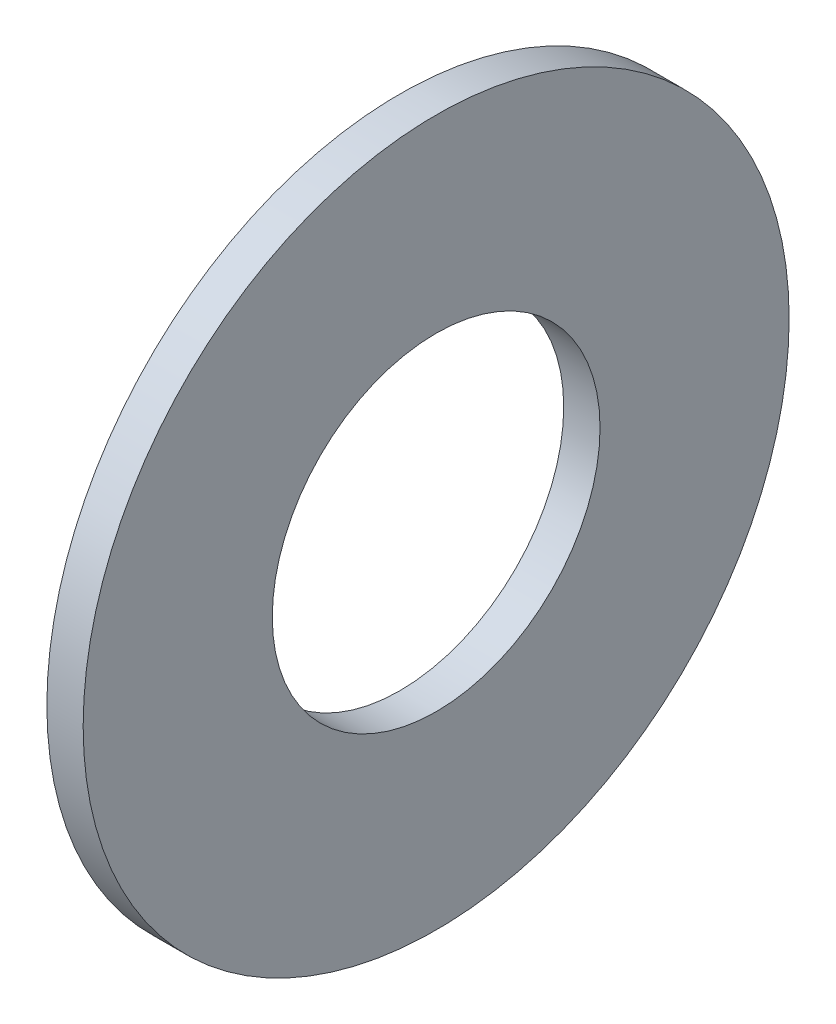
SolidWorks part; units mm, degrees
ref_plane "Plane1" through (0, 0, 0) normal (0, 0, 1) x (1, 0, 0)
ref_plane "Plane2" through (0, 0, 0) normal (0, 1, 0) x (1, 0, 0)
ref_plane "Plane3" through (0, 0, 0) normal (1, 0, 0) x (0, 0, -1)
sketch "Sketch1" plane through (0, 0, 0) normal (0, 0, 1) x (1, 0, 0)
  line L0 (-34.925, 0) -> (9.525, 0) construction
  line L1 (0, 20.6375) -> (0, 44.45)
  line L2 (0, 44.45) -> (-4.572, 44.45)
  line L3 (-4.572, 44.45) -> (-4.572, 20.6375)
  line L4 (-4.572, 20.6375) -> (0, 20.6375)
  dimension "Thickness" = 4.572
  dimension "Inside_dia" = 41.275
  dimension "Outside_dia" = 88.9
revolve "Base-Revolve" add sketch "Sketch1" angle 360 about L0
